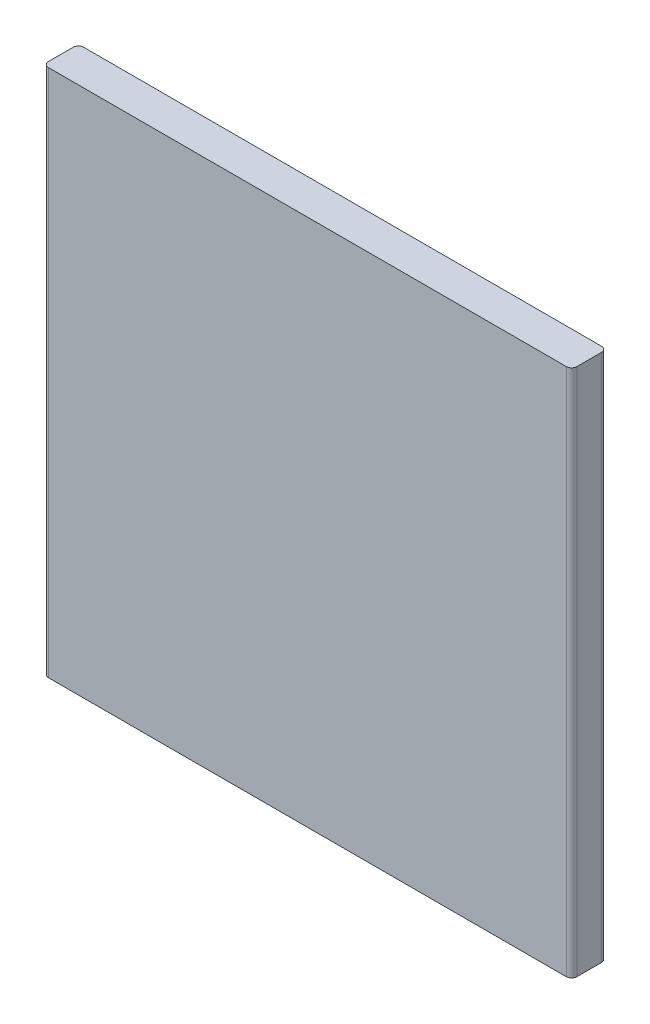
SolidWorks part; units mm, degrees
other "DetailItem1"
other "DetailItem2"
other "DetailItem3"
other "DetailItem4"
ref_plane "Front Plane" through (0, 0, 0) normal (0, 0, 1) x (1, 0, 0)
ref_plane "Top Plane" through (0, 0, 0) normal (0, 1, 0) x (1, 0, 0)
ref_plane "Right Plane" through (0, 0, 0) normal (1, 0, 0) x (0, 0, -1)
sketch "Sketch1" plane through (0, 0, 0) normal (0, 0, 1) x (1, 0, 0)
  line L1 (0, 0) -> (30, 0)
  line L2 (0, 0) -> (0, 30)
  line L3 (0, 30) -> (30, 30)
  line L4 (30, 0) -> (30, 30)
extrude "Boss-Extrude1" add sketch "Sketch1" along normal blind 2
fillet "Fillet1" radius 0.3 4 edges at (30, 15, 2) (30, 15, 0) (0, 15, 0) (0, 15, 2)
